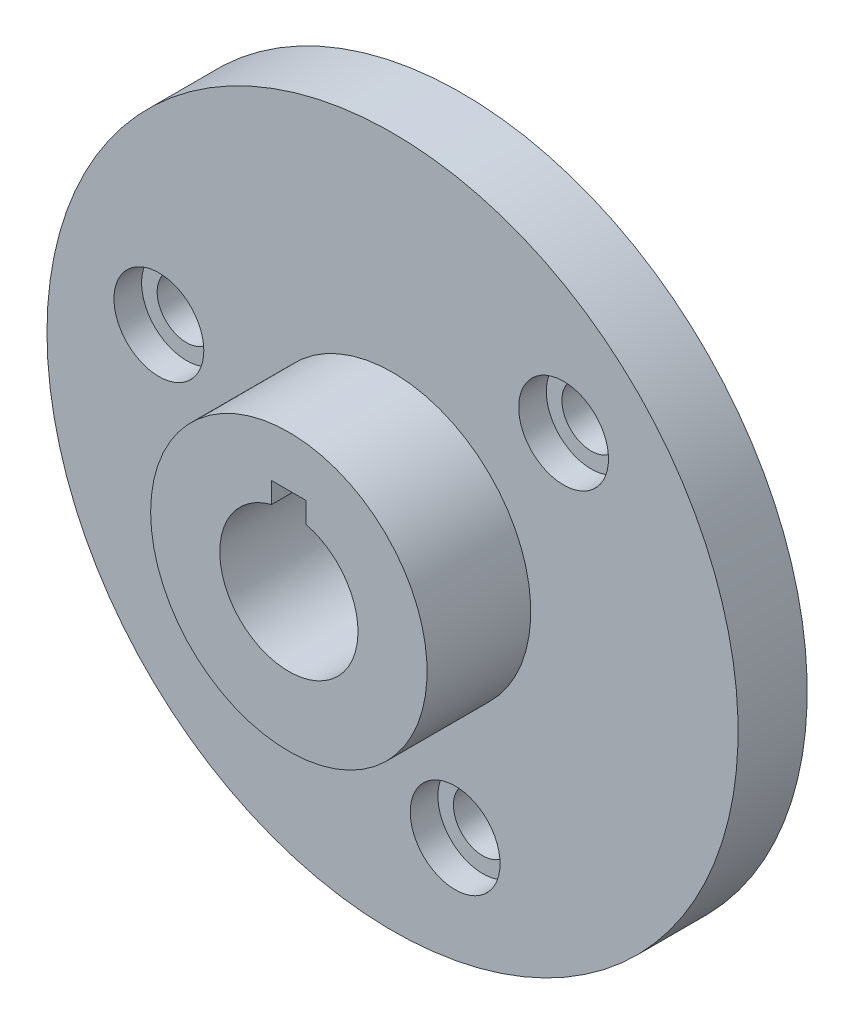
SolidWorks part; units mm, degrees
ref_plane "Front" through (0, 0, 0) normal (0, 0, 1) x (1, 0, 0)
ref_plane "Top" through (0, 0, 0) normal (0, 1, 0) x (1, 0, 0)
ref_plane "Right" through (0, 0, 0) normal (1, 0, 0) x (0, 0, -1)
sketch "Sketch1" plane through (0, 0, 0) normal (-1, 0, 0) x (0, 0, 1)
  line L0 (0, 0) -> (71.6266, 0) construction
  line L1 (0, 0) -> (0, 20)
  line L2 (0, 20) -> (-15, 20)
  line L3 (-15, 20) -> (-15, 50)
  line L4 (-15, 50) -> (-25, 50)
  line L5 (-25, 50) -> (-25, 0)
  line L6 (-25, 0) -> (0, 0)
  dimension "D1" = 40
  dimension "D2" = 100
  dimension "D3" = 10
  dimension "D4" = 15
revolve "Revolve1" add sketch "Sketch1" angle 360 about L0
sketch "Sketch2" plane through (0, 0, 0) normal (0, 0, 1) x (1, 0, 0)
  circle A0 centre (0, 0) radius 10
  dimension "D1" = 20
extrude "Cut-Extrude1" cut sketch "Sketch2" against normal through all
hole_wizard "CBORE for M8 Hex Head Bolt1" positions "Sketch5" profile "Sketch6" counterbore size "M8" standard "ANSI Metric"
sketch "Sketch5" plane through (0, 0, -15) normal (0, 0, 1) x (1, 0, 0)
  circle A0 centre (0, 0) radius 35 construction
  point P0 (24.7487, 24.7487)
  point P15 (9.0587, -33.8074)
  point P16 (-33.8074, 9.0587)
  dimension "D1" = 70
  dimension "D3" = 3
sketch "Sketch6" plane through (24.7487, 24.7487, -15) normal (1, 0, 0) x (0, -1, 0)
  line L0 (0, 0) -> (0, 10)
  line L1 (0, 10) -> (4.25, 10)
  line L3 (4.25, 10) -> (4.25, 4)
  line L4 (4.25, 4) -> (6.5, 4)
  line L5 (6.5, 4) -> (6.5, 0)
  line L7 (6.5, 0) -> (0, 0)
  line L11 (0, -6.35) -> (0, 107.95) construction
  dimension "Thru Hole Dia." = 8.5
  dimension "Thru Hole Depth" = 10
  dimension "C'Bore Dia." = 13
  dimension "C'Bore Depth" = 4
sketch "Sketch3" plane through (0, 0, -15) normal (0, 0, 1) x (1, 0, 0)
  line L0 (0, 0) -> (24.7487, 24.7487) construction
  line L1 (0, 0) -> (50, 0) construction
  circle A0 centre (24.7487, 24.7487) radius 4
  circle A1 centre (0, 0) radius 50 construction
  dimension "D3" = 8
  dimension "D1" = 45
  dimension "D2" = 35
extrude "Cut-Extrude2" [suppressed] cut sketch "Sketch3" against normal through all
pattern_circular "CirPattern1" [suppressed] count 3 over 360
sketch "Sketch4" plane through (0, 0, 0) normal (0, 0, 1) x (1, 0, 0)
  line L0 (0, 0) -> (0, 20) construction
  line L1 (2.5, 9.6825) -> (2.5, 12.6825)
  line L2 (2.5, 12.6825) -> (-2.5, 12.6825)
  line L3 (-2.5, 9.6825) -> (-2.5, 12.6825)
  circle A0 centre (0, 0) radius 20 construction
  circle A1 centre (0, 0) radius 10 construction
  arc A2 (2.5, 9.6825) -> (-2.5, 9.6825) centre (0, 0) ccw
  point P11 (0, 12.6825)
  dimension "D1" = 5
  dimension "D2" = 3
extrude "Cut-Extrude3" cut sketch "Sketch4" against normal through all
